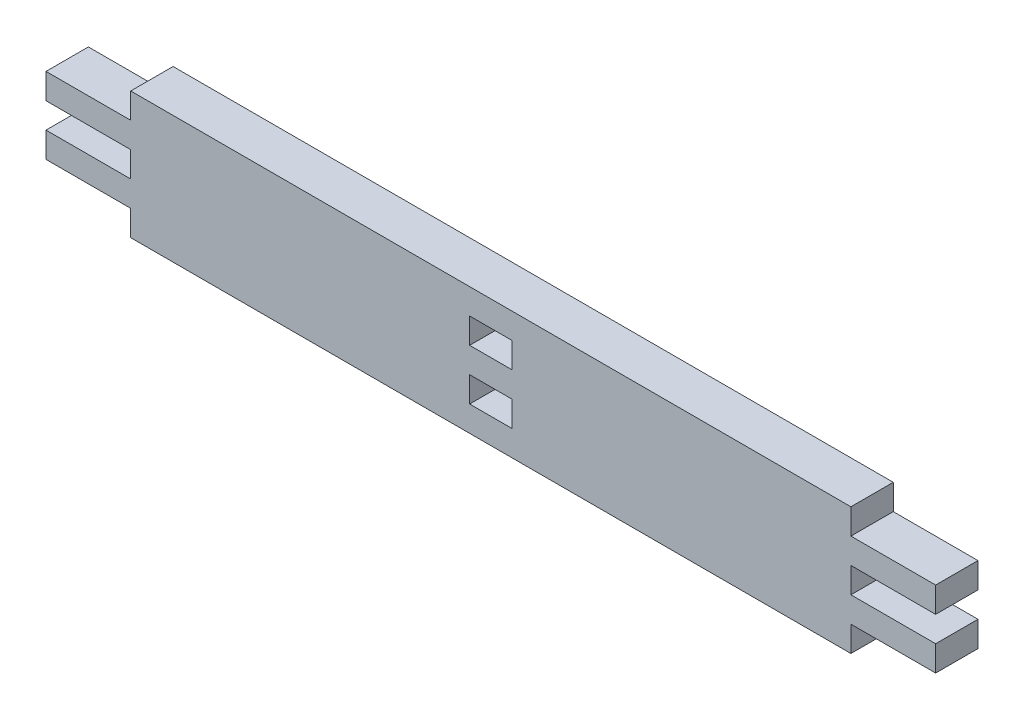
SolidWorks part; units mm, degrees
ref_plane "Front Plane" through (0, 0, 0) normal (0, 0, 1) x (1, 0, 0)
ref_plane "Top Plane" through (0, 0, 0) normal (0, 1, 0) x (1, 0, 0)
ref_plane "Right Plane" through (0, 0, 0) normal (1, 0, 0) x (0, 0, -1)
sketch "Sketch1" plane through (0, 0, 0) normal (0, 0, 1) x (1, 0, 0)
  line L1 (-31.5, -4.5) -> (31.5, -4.5)
  line L2 (-31.5, -4.5) -> (-31.5, 4.5)
  line L3 (-31.5, 4.5) -> (31.5, 4.5)
  line L4 (31.5, -4.5) -> (31.5, 4.5)
  line L5 (-31.5, -4.5) -> (31.5, 4.5) construction
  line L6 (-31.5, 4.5) -> (31.5, -4.5) construction
  point P0 (0, 0)
  dimension "D1" = 63
  dimension "D2" = 9
extrude "Boss-Extrude1" add sketch "Sketch1" along normal blind 3
sketch "Sketch2" plane through (0, 0, 3) normal (0, 0, 1) x (1, 0, 0)
  line L0 (31.5, 4.5) -> (-31.5, 4.5) construction
  line L1 (-31.5, 4.5) -> (-25.5, 4.5)
  line L2 (-31.5, 4.5) -> (-31.5, 2.7)
  line L3 (-31.5, 2.7) -> (-25.5, 2.7)
  line L4 (-25.5, 4.5) -> (-25.5, 2.7)
  line L5 (-31.5, 4.5) -> (-31.5, -4.5) construction
  line L6 (-31.5, 0.9) -> (-25.5, 0.9)
  line L7 (-31.5, 0.9) -> (-31.5, -0.9)
  line L8 (-31.5, -0.9) -> (-25.5, -0.9)
  line L9 (-25.5, 0.9) -> (-25.5, -0.9)
  line L10 (-31.5, -2.7) -> (-25.5, -2.7)
  line L11 (-31.5, -2.7) -> (-31.5, -4.5)
  line L12 (-31.5, -4.5) -> (-25.5, -4.5)
  line L13 (-25.5, -2.7) -> (-25.5, -4.5)
  dimension "D1" = 1.8
  dimension "D2" = 3
extrude "Cut-Extrude1" cut sketch "Sketch2" against normal blind 10
mirror "Mirror1" about plane through (0, 0, 0) normal (1, 0, 0) of "Cut-Extrude1"
sketch "Sketch3" plane through (0, 0, 3) normal (0, 0, 1) x (1, 0, 0)
  line L1 (-1.5, 2.7) -> (1.5, 2.7)
  line L2 (-1.5, 2.7) -> (-1.5, 0.9)
  line L3 (-1.5, 0.9) -> (1.5, 0.9)
  line L4 (1.5, 2.7) -> (1.5, 0.9)
  line L5 (1.5, -0.9) -> (-1.5, -0.9)
  line L6 (1.5, -0.9) -> (1.5, -2.7)
  line L7 (1.5, -2.7) -> (-1.5, -2.7)
  line L8 (-1.5, -0.9) -> (-1.5, -2.7)
extrude "Cut-Extrude2" cut sketch "Sketch3" against normal blind 10
